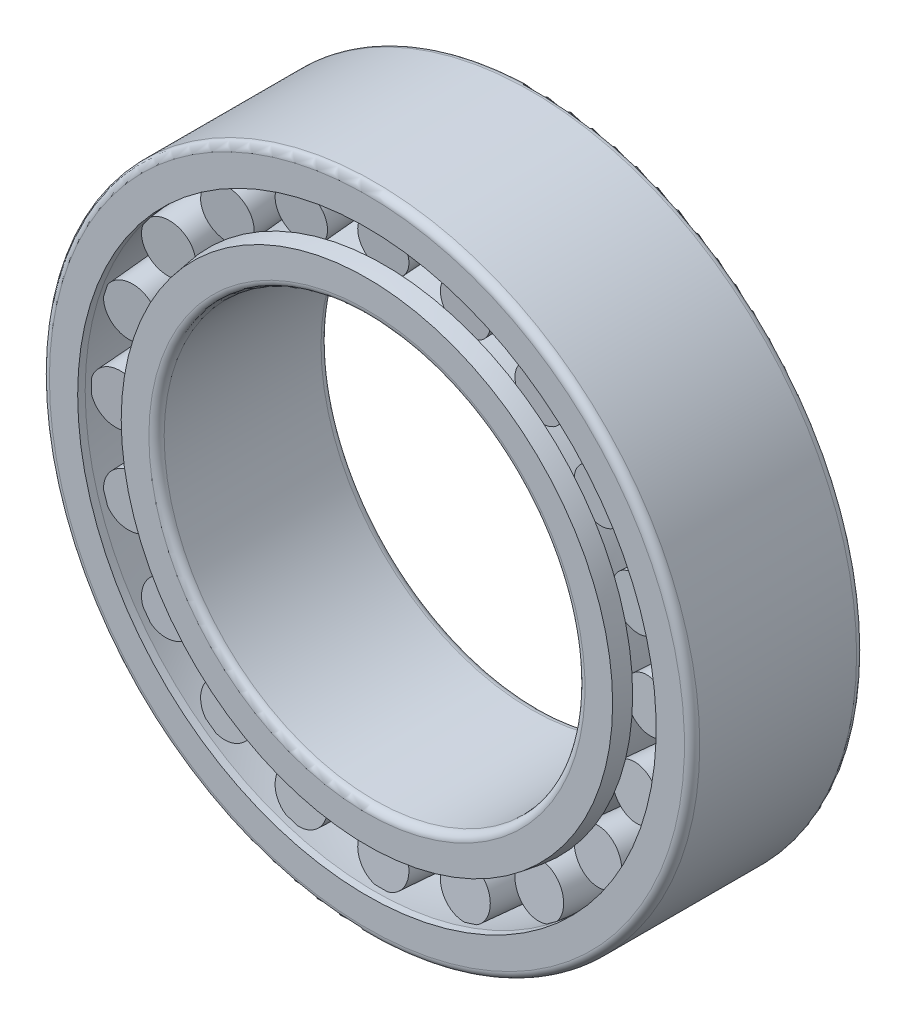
SolidWorks part; units mm, degrees
ref_plane "Front Plane" through (0, 0, 0) normal (0, 0, 1) x (1, 0, 0)
ref_plane "Top Plane" through (0, 0, 0) normal (0, 1, 0) x (1, 0, 0)
ref_plane "Right Plane" through (0, 0, 0) normal (1, 0, 0) x (0, 0, -1)
sketch "BaseSke" plane through (0, 0, 0) normal (1, 0, 0) x (0, 0, -1)
  line L0 (-47.2296, 0) -> (69.4868, 0) construction
  line L2 (0, 129.5214) -> (0, 77.0526) construction
  line L3 (-22.5, 55) -> (-22.5, 64.2308) construction
  line L4 (-22.5, 85) -> (22.5, 85) construction
  line L5 (-22.5, 55) -> (22.5, 55) construction
  line L7 (22.5, 55) -> (22.5, 64.2308) construction
  line L8 (22.5, 75.3077) -> (22.5, 85) construction
  line L9 (-22.5, 75.3077) -> (-22.5, 85) construction
  line L11 (0, 71.5858) -> (-22.5, 69.7692) construction
  line L12 (0, 71.5858) -> (22.5, 69.7692) construction
  line L13 (-22.5, 75.3077) -> (-22.5, 64.2308) construction
  line L14 (0, 66.119) -> (0, -86.3012) construction
  line L15 (0, 77.0526) -> (0, 66.119) construction
  line L16 (-18.213, 69.3629) -> (-17.6761, 62.7121) construction
  line L17 (-18.75, 76.0137) -> (-3.7987, 77.2208)
  line L18 (-18.75, 76.0137) -> (-18.213, 69.3629)
  line L19 (-17.6761, 62.7121) -> (-2.7247, 63.9193) construction
  line L20 (-3.7987, 77.2208) -> (-3.2617, 70.57)
  line L21 (-2.7247, 63.9193) -> (-3.2617, 70.57) construction
  line L22 (-18.213, 69.3629) -> (-3.2617, 70.57)
  line L23 (-22.5, 69.0168) -> (0, 70.8334) construction
  arc A1 (-22.5, 75.3077) -> (22.5, 75.3077) centre (0, -68.881) cw construction
  arc A2 (22.5, 64.2308) -> (-22.5, 64.2308) centre (0, -68.881) ccw construction
  dimension "D2" = 9.2308
  dimension "D1" = 135
  dimension "Bearing_Thickness" = 45
  dimension "Bearing_Outside_Diameter" = 170
  dimension "Bearing_Inside_Diameter" = 110
  dimension "D3" = 9.6923
  dimension "D4" = 15
  dimension "D5" = 3.75
  dimension "D6" = 0.75
revolve "Roller" add sketch "BaseSke" angle 360 about L23
sketch "OuterRaceSke" plane through (0, 0, 0) normal (1, 0, 0) x (0, 0, -1)
  line L0 (0, 0) -> (0, 94.5438) construction
  line L1 (-22.5, 85) -> (22.5, 85)
  line L2 (-22.5, 85) -> (-22.5, 75.2875)
  line L3 (22.5, 85) -> (22.5, 75.2875)
  line L5 (-50.3916, 0) -> (55.2197, 0) construction
  arc A0 (-22.5, 75.2875) -> (22.5, 75.2875) centre (0, -68.881) cw
  arc A2 (22.5, 75.3077) -> (-22.5, 75.3077) centre (0, -68.881) ccw construction
  dimension "D1" = 0.02
revolve "OuterRace" add sketch "OuterRaceSke" angle 360 about L5
sketch "InnerRaceSke" plane through (0, 0, 0) normal (1, 0, 0) x (0, 0, -1)
  line L0 (-70.8626, 0) -> (113.5527, 0) construction
  line L1 (0, 90.393) -> (0, -90.393) construction
  line L2 (-22.5, 55) -> (22.5, 55)
  line L3 (-22.5, 55) -> (-22.5, 64.2308)
  line L4 (-17.9546, 64.9197) -> (-17.7774, 62.724)
  line L5 (-17.7774, 62.724) -> (-2.6267, 63.9472)
  line L7 (-2.6267, 63.9472) -> (-2.7997, 66.0899)
  line L8 (-18.213, 69.3629) -> (-17.6761, 62.7121) construction
  line L9 (2.6267, 63.9472) -> (2.7997, 66.0899)
  line L10 (-2.7247, 63.9193) -> (-3.2617, 70.57) construction
  line L11 (-17.6761, 62.7121) -> (-2.7247, 63.9193) construction
  line L14 (17.7774, 62.724) -> (2.6267, 63.9472)
  line L15 (17.9546, 64.9197) -> (17.7774, 62.724)
  line L16 (22.5, 55) -> (22.5, 64.2308)
  arc A0 (-22.5, 64.2308) -> (-17.9546, 64.9197) centre (0, -68.881) cw
  arc A1 (22.5, 64.2308) -> (-22.5, 64.2308) centre (0, -68.881) ccw construction
  arc A2 (-2.7997, 66.0899) -> (2.7997, 66.0899) centre (0, -68.881) cw
  arc A3 (22.5, 64.2308) -> (17.9546, 64.9197) centre (0, -68.881) ccw
  point P38 (0, 55)
  dimension "D2" = 0.1
  dimension "D1" = 0.02
  dimension "D3" = 0.1
revolve "InnerRace" add sketch "InnerRaceSke" angle 360 about L0
mirror "MirrorRoller" about plane through (0, 0, 0) normal (0, 0, 1) of "Roller"
fillet "Fillet1" radius 2 4 edges at (55, 0, 22.5) (85, 0, 22.5) (55, 0, -22.5) (85, 0, -22.5)
sketch "CutGrooveSke" plane through (0, 0, 0) normal (1, 0, 0) x (0, 0, -1)
  line L0 (-51.8407, 0) -> (83.8302, 0) construction
  line L1 (-11.25, -103.3) -> (-13.5, -103.3)
  line L2 (-11.25, -103.3) -> (-11.25, -83.3)
  line L3 (-11.25, -83.3) -> (-13.5, -83.3)
  line L4 (-13.5, -103.3) -> (-13.5, -83.3)
  dimension "D1" = 83.3
  dimension "D2" = 11.25
  dimension "D3" = 2.25
  dimension "D4" = 20
revolve "CutGroove" [suppressed] cut sketch "CutGrooveSke" angle 360 about L0
sketch "TaperSke" plane through (0, 0, 0) normal (1, 0, 0) x (0, 0, -1)
  line L0 (-22.5, 55) -> (22.5, 55)
  line L1 (22.5, 55) -> (22.5, 58.75)
  line L2 (22.5, 58.75) -> (-22.5, 55)
  line L7 (-41.2502, 0) -> (40.8606, 0) construction
  dimension "Taper" = 3.75
revolve "Taper" [suppressed] cut sketch "TaperSke" angle 360 about L7
fillet "Fillet2" [suppressed] radius 2
pattern_circular "CirPatternBall" count 20 over 360 about axis through (0, 0, 0) along (0, 0, 1) of "Roller", "MirrorRoller"
sketch "SimplifiedSke" plane through (0, 0, 0) normal (1, 0, 0) x (0, 0, -1)
  line L0 (37.5911, 0) -> (-37.5911, 0) construction
  line L1 (0, 0) -> (0, 96.8272) construction
  line L2 (-17.6761, 62.7121) -> (-2.7247, 63.9193)
  line L3 (-17.6761, 62.7121) -> (-18.75, 76.0137)
  line L4 (-18.75, 76.0137) -> (-3.7987, 77.2208)
  line L5 (-2.7247, 63.9193) -> (-3.7987, 77.2208)
  line L7 (2.7247, 63.9193) -> (3.7987, 77.2208)
  line L8 (17.6761, 62.7121) -> (2.7247, 63.9193)
  line L9 (17.6761, 62.7121) -> (18.75, 76.0137)
  line L10 (18.75, 76.0137) -> (3.7987, 77.2208)
revolve "Simplified" [suppressed] add sketch "SimplifiedSke" angle 360 about L0
chamfer "Chamfer" distance 1.875 angle 10 2 edges at (75.2875, 0, -22.5) (75.2875, 0, 22.5)
equation "\"D1@BaseSke\" = \"Bearing_Thickness@BaseSke\"*3"
equation "\"D2@BaseSke\" =  ( \"Bearing_Outside_Diameter@BaseSke\" - \"Bearing_Inside_Diameter@BaseSke\" ) /6.5"
equation "\"D3@BaseSke\" = \"D2@BaseSke\"*1.05"
equation "\"D4@BaseSke\" = \"Bearing_Thickness@BaseSke\"/3"
equation "\"D5@BaseSke\" = \"Bearing_Thickness@BaseSke\"/12"
equation "\"D6@BaseSke\" = \"Bearing_Thickness@BaseSke\"/60"
equation "\"D1@CutGrooveSke\" = \"Bearing_Outside_Diameter@BaseSke\" * 0.49"
equation "\"D2@CutGrooveSke\" = \"Bearing_Thickness@BaseSke\" *0.25"
equation "\"D3@CutGrooveSke\" = \"Bearing_Thickness@BaseSke\"/20"
equation "\"Taper@TaperSke\" = \"Bearing_Thickness@BaseSke\"/12"
equation "\"D1@Fillet2\" = \"Fillet_radius@Fillet1\""
equation "\"D1@CirPatternBall\" =  int(  ( \"Bearing_Outside_Diameter@BaseSke\" + \"Bearing_Inside_Diameter@BaseSke\" )  / 2 *  pi  /  ( \"Bearing_Outside_Diameter@BaseSke\" - \"Bearing_Inside_Diameter@BaseSke\" ) * 2.8 "
equation "\"D1@Chamfer\" = \"Bearing_Thickness@BaseSke\"/24"
